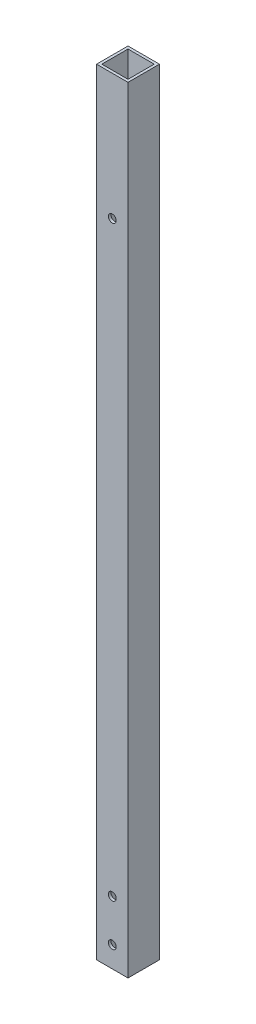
SolidWorks part; units mm, degrees
ref_plane "Front Plane" through (0, 0, 0) normal (0, 0, 1) x (1, 0, 0)
ref_plane "Top Plane" through (0, 0, 0) normal (0, 1, 0) x (1, 0, 0)
ref_plane "Right Plane" through (0, 0, 0) normal (1, 0, 0) x (0, 0, -1)
sketch "Sketch1" plane through (0, 0, 0) normal (0, 1, 0) x (1, 0, 0)
  line L1 (-19.05, 19.05) -> (19.05, 19.05)
  line L2 (-19.05, 19.05) -> (-19.05, -19.05)
  line L3 (-19.05, -19.05) -> (19.05, -19.05)
  line L4 (19.05, 19.05) -> (19.05, -19.05)
  line L5 (-15.875, 15.875) -> (15.875, 15.875)
  line L6 (-15.875, 15.875) -> (-15.875, -15.875)
  line L7 (-15.875, -15.875) -> (15.875, -15.875)
  line L8 (15.875, 15.875) -> (15.875, -15.875)
  dimension "D1" = 38.1
  dimension "D2" = 38.1
  dimension "D3" = 19.05
  dimension "D4" = 19.05
  dimension "D5" = 3.175
  dimension "D6" = 3.175
  dimension "D7" = 3.175
  dimension "D8" = 3.175
extrude "Boss-Extrude1" add sketch "Sketch1" along normal blind 939.8
sketch "Sketch5" plane through (0, 0, -19.05) normal (0, 0, -1) x (-1, 0, 0)
  line L0 (-19.05, 0) -> (19.05, 0) construction
  line L1 (-19.05, 939.8) -> (19.05, 939.8) construction
  circle A0 centre (0, 25.4) radius 4.7625
  circle A1 centre (0, 76.2) radius 4.7625
  circle A2 centre (0, 787.4) radius 4.7625
  point P8 (0, 939.8)
  dimension "D1" = 9.525
  dimension "D2" = 9.525
  dimension "D3" = 9.525
  dimension "D4" = 25.4
  dimension "D5" = 50.8
  dimension "D6" = 152.4
extrude "Cut-Extrude3" cut sketch "Sketch5" against normal through all
